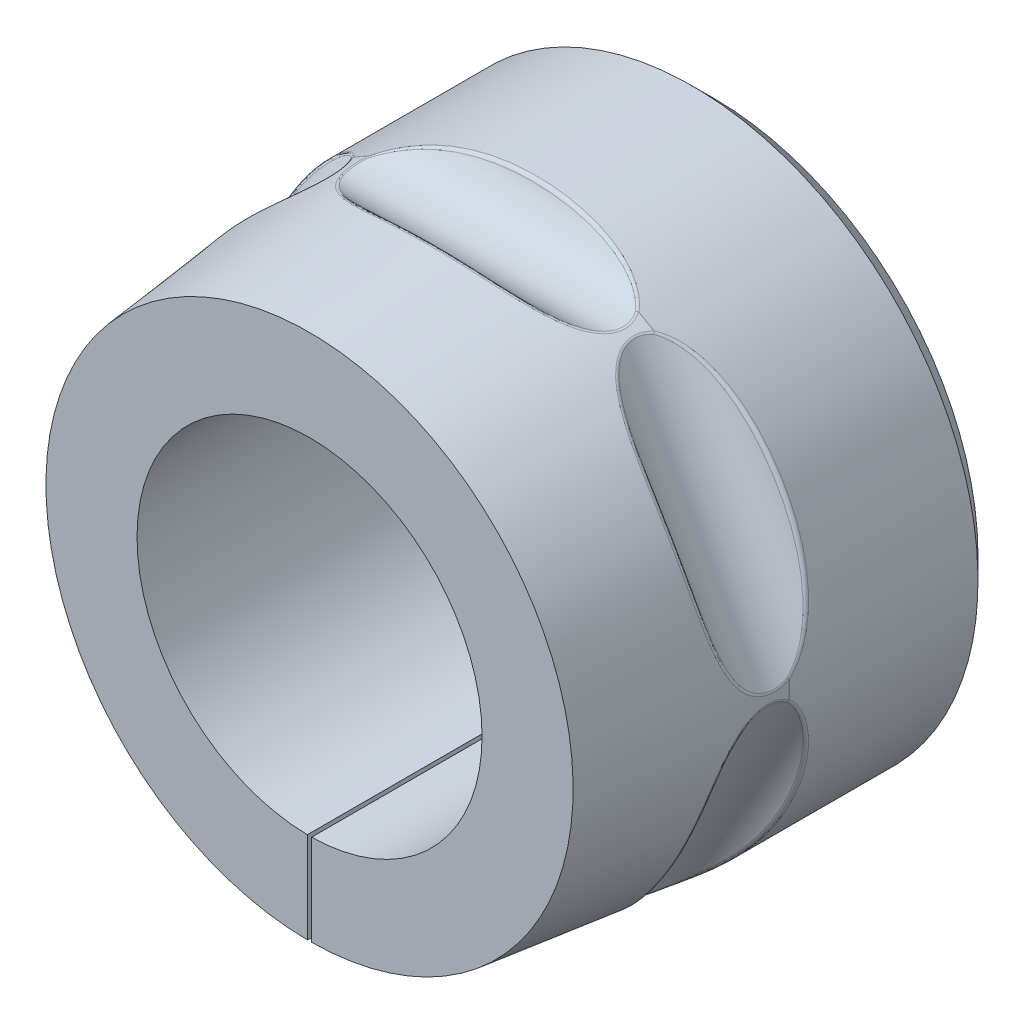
SolidWorks part; units mm, degrees
ref_plane "Ebene vorne" through (0, 0, 0) normal (0, 0, 1) x (1, 0, 0)
ref_plane "Ebene oben" through (0, 0, 0) normal (0, 1, 0) x (1, 0, 0)
ref_plane "Ebene rechts" through (0, 0, 0) normal (1, 0, 0) x (0, 0, -1)
imported_body "Basisteil-Dichtungshülse-1"
fillet "Verrundung1" radius 0.2 18 edges at (-6.625, 11.4748, -35) (-13.25, 0, -35) (-6.625, -11.4748, -35) (6.625, -11.4748, -35) (13.25, 0, -35) (6.625, 11.4748, -35) (12.1774, -4.2421, -31.8851) (11.2549, -6.9921, -31.6173) (2.4149, -12.6669, -31.8851) (-0.4278, -13.2431, -31.6173) (-9.7624, -8.4249, -31.8851) (-11.6828, -6.251, -31.6173) (-12.1774, 4.2421, -31.8851) (-11.2549, 6.9921, -31.6173) (-2.4149, 12.6669, -31.8851) (-0.6734, 13.2329, -36.3794) (11.6828, 6.251, -31.6173) (9.7624, 8.4249, -31.8851)
ref_plane "Ebene1" through (0, 0, 0) normal (-0.5, -0.866, 0) x (-0.866, 0.5, 0)
ref_plane "Ebene2" through (0, 0, 0) normal (-0.5, 0.866, 0) x (0.866, 0.5, 0)
sketch "Skizze1" plane through (0, 0, 0) normal (0, 1, 0) x (1, 0, 0)
  line L0 (0, 42.75) -> (0, 26) construction
  line L1 (0.1, 23.5189) -> (-0.1, 23.5189)
  line L2 (0.1, 23.5189) -> (0.1, 48.253)
  line L3 (0.1, 48.253) -> (-0.1, 48.253)
  line L4 (-0.1, 23.5189) -> (-0.1, 48.253)
  line L5 (0.1, 23.5189) -> (-0.1, 48.253) construction
  line L6 (0.1, 48.253) -> (-0.1, 23.5189) construction
  point P0 (0, 35.886)
  dimension "D1" = 0.2
extrude "Schnitt-Linear austragen1" cut sketch "Skizze1" against normal through all
